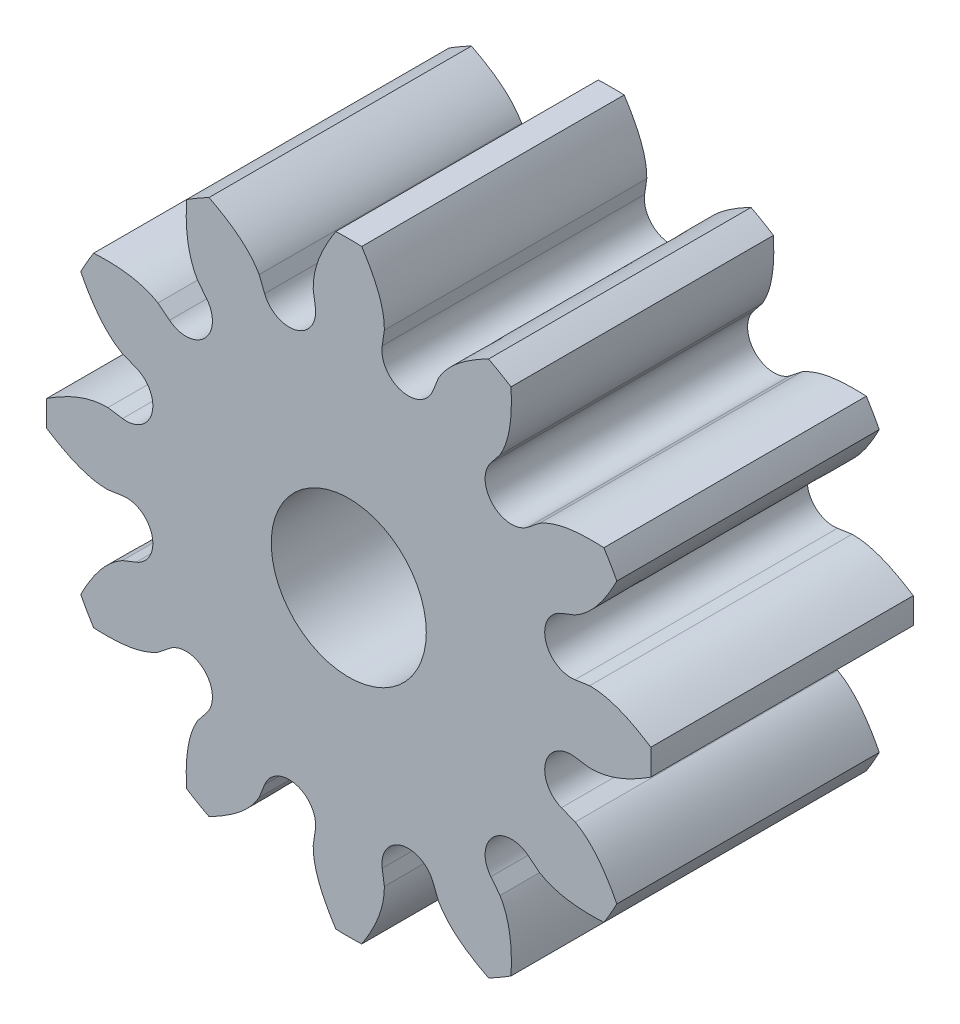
SolidWorks part; units mm, degrees
ref_plane "Front Plane" through (0, 0, 0) normal (0, 0, 1) x (1, 0, 0)
ref_plane "Top Plane" through (0, 0, 0) normal (0, 1, 0) x (1, 0, 0)
ref_plane "Right Plane" through (0, 0, 0) normal (1, 0, 0) x (0, 0, -1)
sketch "Involute construction sketch" plane through (0, 0, 0) normal (0, 0, 1) x (1, 0, 0)
  line L0 (0, 0) -> (-1.7439, 2.1811) construction
  line L1 (0, 0) -> (-1.0894, 2.5713) construction
  line L2 (0, 0) -> (-0.3538, 2.7701) construction
  line L3 (0, 0) -> (0.4081, 2.7626) construction
  line L4 (-2.6243, 0.9546) -> (-2.2686, 1.6285) construction
  line L5 (-2.2686, 1.6285) -> (-1.7439, 2.1811) construction
  line L6 (-1.7439, 2.1811) -> (-1.0894, 2.5713) construction
  line L7 (0, 0) -> (-2.2686, 1.6285) construction
  line L8 (0, 0) -> (-2.6243, 0.9546) construction
  line L9 (-1.0894, 2.5713) -> (-0.3538, 2.7701) construction
  line L10 (-0.3538, 2.7701) -> (0.4081, 2.7626) construction
  line L11 (-2.6243, 0.9546) -> (-1.3219, 4.5351) construction
  line L12 (-2.2686, 1.6285) -> (-0.4912, 4.1046) construction
  line L13 (-1.7439, 2.1811) -> (0.0415, 3.6087) construction
  line L14 (-1.0894, 2.5713) -> (0.3138, 3.1658) construction
  line L15 (-0.3538, 2.7701) -> (0.402, 2.8666) construction
  line L17 (0, 0) -> (0, 5.7859) construction
  line L18 (0, 0) -> (0.3879, 2.9464) construction
  line L19 (0, 0) -> (0.6048, 2.2572) construction
  circle A0 centre (0, 0) radius 2.3368 construction
  circle A1 centre (0, 0) radius 2.7926 construction
  circle A2 centre (0, 0) radius 2.9718 construction
  circle A3 centre (0, 0) radius 3.4671 construction
  spline S0 degree 3 poles (0.4081, 2.7626) (0.4101, 2.9021) (0.3192, 3.2075) (-0.15, 3.946) (-0.8068, 4.3472) (-1.3219, 4.5351) knots 0 0 0 0 0.160098 0.360084 1 1 1 1 construction
  point P17 (0.1486, 3.4639)
sketch "Sketch2" plane through (0, 0, 0) normal (0, 0, 1) x (1, 0, 0)
  line L0 (0, 3.4671) -> (0, 2.3368)
  line L1 (0, 0) -> (0, 5.7859) construction
  line L2 (0.4081, 2.7626) -> (0.3833, 2.5944)
  line L3 (0, 0) -> (0.4081, 2.7626) construction
  circle A0 centre (0, 0) radius 3.4671 construction
  circle A1 centre (0, 0) radius 2.3368 construction
  arc A2 (0, 3.4671) -> (0.1486, 3.4639) centre (0, 0) cw
  arc A3 (0, 2.3368) -> (0.6048, 2.2572) centre (0, 0) cw
  arc A4 (0.3833, 2.5944) -> (0.6048, 2.2572) centre (0.6833, 2.5501) ccw
  spline S0 degree 3 poles (0.4081, 2.7626) (0.4091, 2.8245) (0.3774, 3.0766) (0.25, 3.3056) (0.1486, 3.4639) knots 0 0 0 0 0.244448 1 1 1 1
sketch "Sketch3" plane through (0, 0, 0) normal (0, 0, 1) x (1, 0, 0)
  circle A0 centre (0, 0) radius 2.3368
  circle A1 centre (0, 0) radius 0.889
extrude "Base" add sketch "Sketch3" along normal blind 3.0099
extrude "Half tooth" add sketch "Sketch2" along normal up to surface (3.0099 mm away)
ref_plane "Midplane of half tooth" through (0, 0, 0) normal (-1, 0, 0) x (0, 0, 1)
mirror "Mirror of half tooth" about plane through (0, 0, 0) normal (-1, 0, 0) of "Half tooth"
pattern_circular "Pattern of half tooth" count 12 over 360 of "Half tooth", "Mirror of half tooth"
equation "\"radtodeg\"= 180 / PI'radian to degree conversion [ ]"
equation "\"phi\"= 20'pressure angle [deg]"
equation "\"N\"= 12'number of teeth [teeth]"
equation "\"A\"= 0.273in'diameter of addendum circle [inch]"
equation "\"B\"= 0.184in'diameter of dedendum circle [inch]"
equation "\"P\"= ( \"N\" + 2 ) / \"A\"'diametral pitch [teeth/inch]"
equation "\"d\"= \"N\" / \"P\"'diameter of pitch circle [inch]"
equation "\"cp\"= PI / \"P\"'circular pitch [inch/teeth]"
equation "\"add\"= 1 / \"P\"'addendum [inch]"
equation "\"ded\"= - ( \"B\" - \"d\" ) / 2'dedendum [inch]"
equation "\"clear\"= \"ded\" - \"add\"'clearance [inch]"
equation "\"C\"= \"B\" + 2 * \"clear\"'diameter of clearance circle [inch]"
equation "\"h\"= \"add\" + \"ded\"'tooth height / whole depth [inch]"
equation "\"s\"= \"d\" * cos ( \"phi\" * 1 / \"radtodeg\" )'diameter of base circle [inch]"
equation "\"t\"= ( PI / 2 ) / \"P\"'tooth width at diameter of pitch circle diameter [inch]"
equation "\"alpha\"= ( \"t\" / ( \"d\" / 2 ) * \"radtodeg\" ) / 2'arc angle for half of tooth width at pitch circle diameter [inch]"
equation "\"bore\"= 0.07'bore of hub [inch]"
equation "\"D4@Involute construction sketch\"= \"A\"'addendum circle"
equation "\"D3@Involute construction sketch\"= \"d\"'pitch circle"
equation "\"D2@Involute construction sketch\"= \"s\"'base circle"
equation "\"D1@Involute construction sketch\"= \"B\"'dedendum circle"
equation "\"seg\"= \"D5@Involute construction sketch\"'size of one involute segment [inch]"
equation "\"D6@Involute construction sketch\"=2*\"seg\""
equation "\"D7@Involute construction sketch\"=3*\"seg\""
equation "\"D8@Involute construction sketch\"=4*\"seg\""
equation "\"D9@Involute construction sketch\"=5*\"seg\""
equation "\"D10@Involute construction sketch\"=\"alpha\""
equation "\"D11@Involute construction sketch\"=2*\"alpha\""
equation "\"D1@Sketch3\"=\"B\""
equation "\"D2@Sketch3\"=\"bore\""
